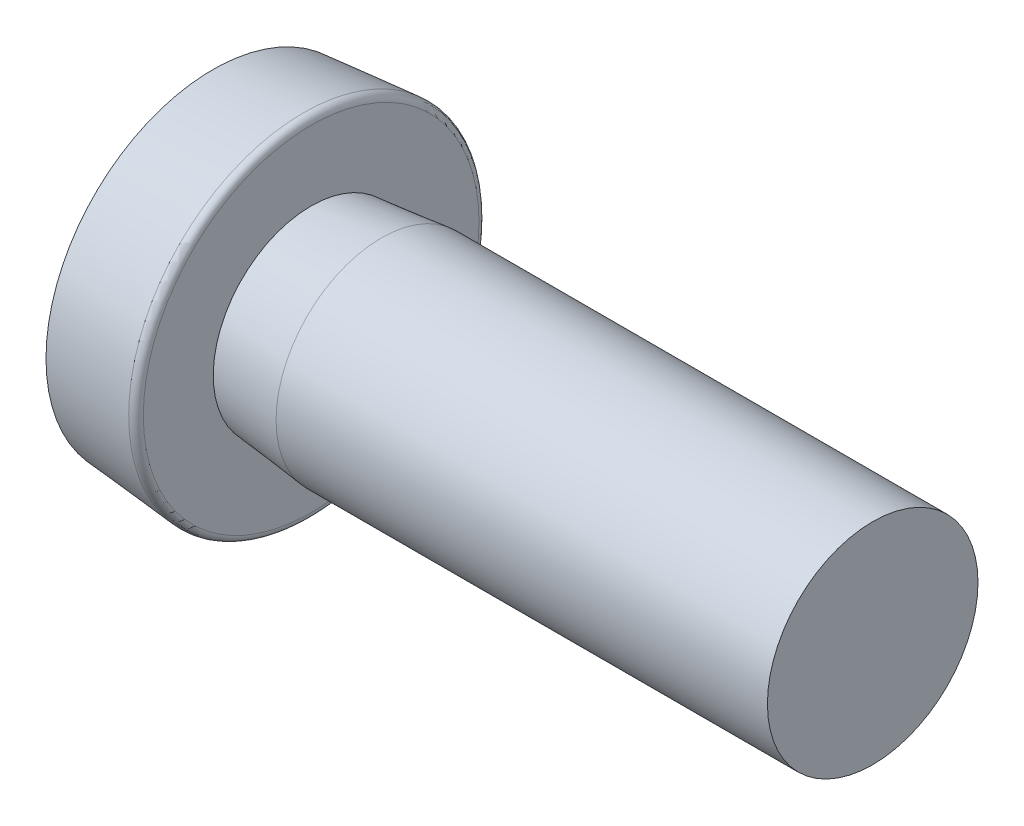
SolidWorks part; units mm, degrees
ref_plane "Front" through (0, 0, 0) normal (0, 0, 1) x (1, 0, 0)
ref_plane "Top" through (0, 0, 0) normal (0, 1, 0) x (1, 0, 0)
ref_plane "Right" through (0, 0, 0) normal (1, 0, 0) x (0, 0, -1)
other "Configuration Table"
ref_plane "Plane1" through (1.4, 0, 0) normal (1, 0, 0) x (0, 0, -1)
sketch "Sketch1" plane through (1.4, 0, 0) normal (1, 0, 0) x (0, 0, -1)
  circle A0 centre (0, 0) radius 2.5
  dimension "dk" = 5
extrude "BaseHead" add sketch "Sketch1" against normal blind 1.4 draft 5
sketch "Sketch2" plane through (1.4, 0, 0) normal (1, 0, 0) x (0, 0, -1)
  circle A0 centre (0, 0) radius 1.5
extrude "BaseBody" add sketch "Sketch2" along normal blind 8
sketch "Sketch3" plane through (0, 0, 0) normal (0, 0, 1) x (1, 0, 0)
  line L0 (2.4, 1.5) -> (2.4, -1.5)
  line L1 (9.4, 1.5) -> (1.4, 1.5) construction
  line L2 (1.4, -1.5) -> (9.4, -1.5) construction
  line L3 (1.4, -2.5) -> (1.4, 2.5) construction
draft "Draft1" draft angle 6 parameters "D1"=6
sketch "Sketch4" plane through (0, 0, 0) normal (1, 0, 0) x (0, 0, -1)
  line L0 (-2.9755, 0) -> (3.4163, 0) construction
  line L1 (0, 2.8391) -> (0, -2.9545) construction
  line L2 (0.27, -0.27) -> (0.27, -1.35)
  line L3 (-0.27, 1.35) -> (0.27, 1.35)
  line L4 (-0.27, 1.35) -> (-0.27, 0.27)
  line L5 (-0.27, -1.35) -> (0.27, -1.35)
  line L6 (0.27, 1.35) -> (0.27, 0.27)
  line L7 (-1.35, 0.27) -> (-0.27, 0.27)
  line L8 (-1.35, 0.27) -> (-1.35, -0.27)
  line L9 (-1.35, -0.27) -> (-0.27, -0.27)
  line L10 (1.35, 0.27) -> (1.35, -0.27)
  line L11 (-0.27, -0.27) -> (-0.27, -1.35)
  line L12 (0.27, 0.27) -> (1.35, 0.27)
  line L13 (0.27, -0.27) -> (1.35, -0.27)
extrude "CrossRecess" cut sketch "Sketch4" along normal blind 0.84
fillet "Fillet1" radius 0.2 4 edges at (0.42, 0.27, -0.27) (0.42, 0.27, 0.27) (0.42, -0.27, -0.27) (0.42, -0.27, 0.27)
draft "Draft2" type of draft neutral plane draft angle 30 faces to draft 4 parameters "D1"=30
fillet "Fillet2" radius 0.1 1 edges at (1.4, 0, -2.5)
sketch "Sketch5" plane through (0, 0, 0) normal (0, 0, 1) x (1, 0, 0)
  line L0 (9.4, 1.1752) -> (9.5875, 1.5)
  line L1 (9.5875, 1.5) -> (9.5875, 1.875)
  line L2 (9.5875, 1.875) -> (9.2125, 1.875)
  line L3 (9.2125, 1.875) -> (9.2125, 1.5)
  line L4 (9.2125, 1.5) -> (9.4, 1.1752)
  line L5 (9.4, -1.5) -> (9.4, 1.5) construction
  line L6 (0, 0) -> (10.998, 0) construction
  line L7 (0, 2.3775) -> (0, -2.3775) construction
revolve "Cut-Revolve10" [suppressed] cut sketch "Sketch5" angle 360 about L6
pattern_linear "LPattern10" [suppressed] count 16 spacing 0.45 along (1, 0, 0)
equation "\"n@Sketch4\" = \"m@Sketch4\" / 5"
equation "\"D1@CrossRecess\"=0.6*\"k@BaseHead\""
equation "\"D1@Plane1\" = \"k@BaseHead\""
equation "\"D1@ThreadCosmetic1\" = \"l@BaseBody\" - \"a@Sketch3\""
equation "\"D1@Sketch5\" = \"d@Sketch2\""
equation "\"D2@Sketch5\" = (  \"d@Sketch2\" - \"THD_MINOR@ThreadCosmetic1\" )  / 2"
equation "\"D3@LPattern10\" = \"D2@Sketch5\" * 1.2"
equation "\"D1@LPattern10\" = \"D1@ThreadCosmetic1\" / \"D3@LPattern10\""
